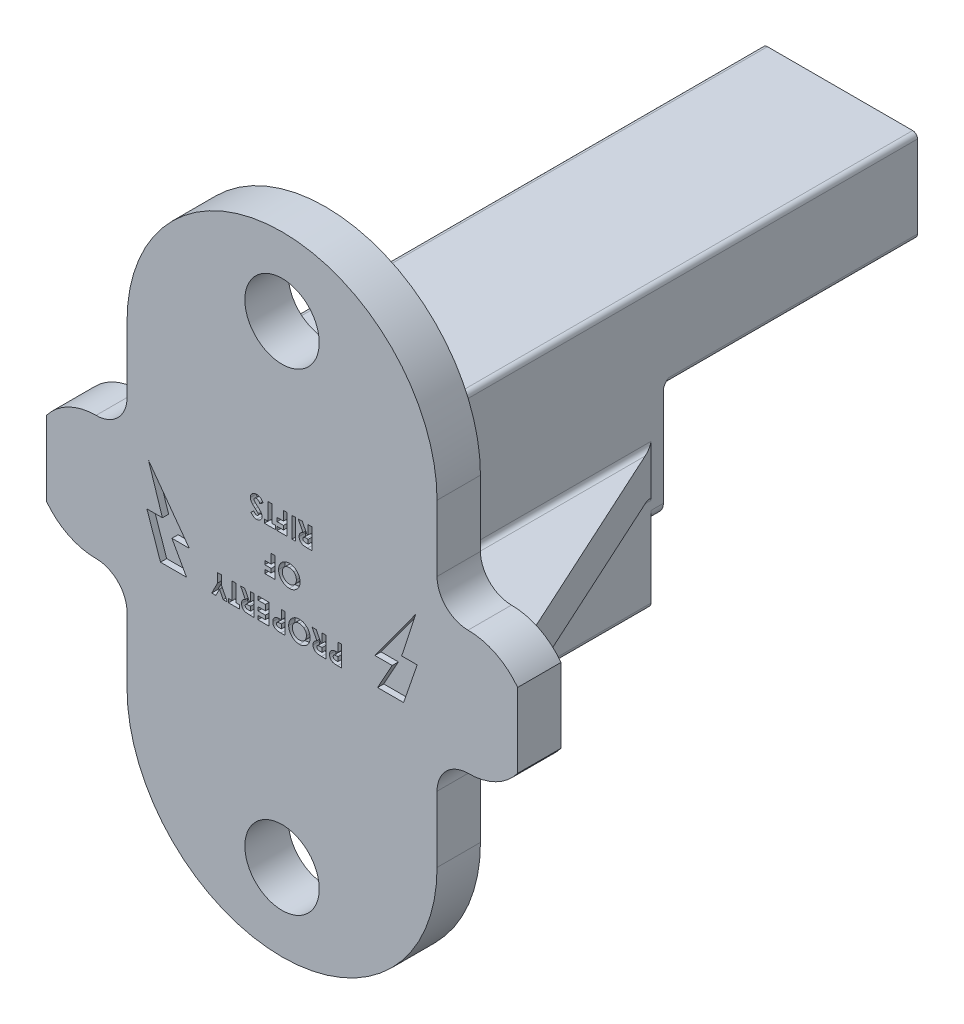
SolidWorks part; units mm, degrees
ref_plane "Front Plane" through (0, 0, 0) normal (0, 0, 1) x (1, 0, 0)
ref_plane "Top Plane" through (0, 0, 0) normal (0, 1, 0) x (1, 0, 0)
ref_plane "Right Plane" through (0, 0, 0) normal (1, 0, 0) x (0, 0, -1)
sketch "Sketch1" plane through (0, 0, 0) normal (0, 0, 1) x (1, 0, 0)
  line L1 (-683.5225, -1291.2464) -> (-651.7725, -1291.2464)
  line L2 (-683.5225, -1291.2464) -> (-683.5225, -1234.1695)
  line L3 (-683.5225, -1291.2464) -> (-651.7725, -1291.2464)
  line L4 (-683.5225, -1234.1695) -> (-651.7725, -1234.1695)
  line L5 (-651.7725, -1291.2464) -> (-651.7725, -1234.1695)
  line L6 (-658.1225, -1276.0275) -> (-677.1725, -1276.0275)
  line L7 (-683.5225, -1282.3775) -> (-683.5225, -1291.2464)
  line L8 (-651.7725, -1291.2464) -> (-651.7725, -1282.3775)
  circle A2 centre (-667.6475, -1337.5375) radius 25
  circle A4 centre (-705.1475, -1337.5375) radius 2.75
  circle A6 centre (-686.3975, -1370.0135) radius 2.75
  circle A8 centre (-648.8975, -1370.0135) radius 2.75
  circle A10 centre (-648.8975, -1305.0616) radius 2.75
  circle A12 centre (-630.1475, -1337.5375) radius 2.75
  circle A14 centre (-686.3975, -1305.0616) radius 2.75
  circle A16 centre (-659.9185, -1285.0159) radius 2.9
  circle A18 centre (-675.3764, -1285.0159) radius 2.9
  arc A28 (-677.1725, -1276.0275) -> (-683.5225, -1282.3775) centre (-677.1725, -1282.3775) ccw
  arc A29 (-687.1241, -1296.9708) -> (-683.5225, -1291.2464) centre (-689.8725, -1291.2464) ccw
  arc A30 (-687.1241, -1296.9708) -> (-648.1709, -1296.9708) centre (-667.6475, -1337.5375) ccw
  arc A31 (-651.7725, -1291.2464) -> (-648.1709, -1296.9708) centre (-645.4225, -1291.2464) ccw
  arc A32 (-651.7725, -1282.3775) -> (-658.1225, -1276.0275) centre (-658.1225, -1282.3775) ccw
extrude "Boss-Extrude1" add sketch "Sketch1" along normal blind 12.7 contours A32 L5 L4 L2 A28 L6 | L5 A32 L6 A28 L2 L1 A18 A16
sketch "Sketch2" plane through (0, 0, 12.7) normal (0, 0, 1) x (1, 0, 0)
  line L0 (-651.7725, -1272.2695) -> (-683.5225, -1272.2695)
  line L4 (-683.5225, -1234.1695) -> (-683.5225, -1291.2464)
  line L5 (-683.5225, -1291.2464) -> (-651.7725, -1291.2464)
  line L6 (-651.7725, -1291.2464) -> (-651.7725, -1234.1695)
  line L7 (-651.7725, -1234.1695) -> (-683.5225, -1234.1695)
  line L8 (-683.5225, -1234.1695) -> (-683.5225, -1291.2464)
  line L9 (-683.5225, -1291.2464) -> (-651.7725, -1291.2464)
  line L10 (-651.7725, -1291.2464) -> (-651.7725, -1234.1695)
  line L11 (-651.7725, -1234.1695) -> (-683.5225, -1234.1695)
  circle A0 centre (-675.3764, -1285.0159) radius 2.9 construction
  circle A1 centre (-659.9185, -1285.0159) radius 2.9 construction
  circle A2 centre (-675.3764, -1285.0159) radius 2.9
  circle A3 centre (-659.9185, -1285.0159) radius 2.9
  dimension "D2" = 38.1
  dimension "D1" = 0
extrude "Boss-Extrude2" add sketch "Sketch2" along normal blind 101.6 contours L0 M8 M9 M6
ref_plane "Plane1" through (-667.6475, 0, 0) normal (1, 0, 0) x (0, 0, -1)
sketch "Sketch7" plane through (0, -1272.2695, 0) normal (0, -1, 0) x (1, 0, 0)
  line L1 (-642.6475, 54.61) -> (-692.6475, 54.61)
  line L4 (-683.5225, 12.7) -> (-651.7725, 12.7)
  line L5 (-651.7725, 12.7) -> (-651.7725, 114.3)
  line L6 (-651.7725, 114.3) -> (-683.5225, 114.3)
  line L7 (-683.5225, 114.3) -> (-683.5225, 12.7)
  line L8 (-683.5225, 12.7) -> (-651.7725, 12.7)
  line L9 (-651.7725, 12.7) -> (-651.7725, 114.3)
  line L10 (-651.7725, 114.3) -> (-683.5225, 114.3)
  line L11 (-683.5225, 114.3) -> (-683.5225, 12.7)
  dimension "D1" = 0
extrude "Boss-Extrude4" add sketch "Sketch7" along normal blind 57.15 contours L1 M6 M7 M8
sketch "Sketch8" plane through (0, 0, 114.3) normal (0, 0, 1) x (1, 0, 0)
  line L4 (-683.5225, -1234.1695) -> (-683.5225, -1329.4195)
  line L5 (-683.5225, -1329.4195) -> (-651.7725, -1329.4195)
  line L6 (-651.7725, -1329.4195) -> (-651.7725, -1234.1695)
  line L7 (-651.7725, -1234.1695) -> (-683.5225, -1234.1695)
  line L8 (-683.5225, -1234.1695) -> (-683.5225, -1329.4195)
  line L9 (-683.5225, -1329.4195) -> (-651.7725, -1329.4195)
  line L10 (-651.7725, -1329.4195) -> (-651.7725, -1234.1695)
  line L11 (-651.7725, -1234.1695) -> (-683.5225, -1234.1695)
  circle A1 centre (-667.6475, -1337.5375) radius 12.3
  circle A2 centre (-667.6475, -1337.5375) radius 25 construction
  dimension "D1" = 0
  dimension "D2" = 12.7
extrude "Cut-Extrude4" cut sketch "Sketch8" against normal through all contours L9 A1
ref_plane "Plane3" through (-667.6475, 0, 0) normal (1, 0, 0) x (0, 0, -1)
sketch "Sketch11" plane through (-667.6475, 0, 0) normal (1, 0, 0) x (0, 0, -1)
  line L0 (-54.61, -1272.2695) -> (-12.7, -1272.2695) construction
  line L1 (-114.3, -1329.4195) -> (-114.3, -1234.1695) construction
  line L2 (0, -1291.2464) -> (0, -1234.1695) construction
  line L3 (-54.61, -1272.2695) -> (-12.7, -1272.2695) construction
  line L4 (-114.3, -1329.4195) -> (-114.3, -1234.1695) construction
  line L5 (0, -1291.2464) -> (0, -1234.1695) construction
  line L6 (-54.61, -1272.2695) -> (-114.3, -1272.2695) construction
  line L7 (0, -1243.1425) -> (-114.3, -1263.2966)
  line L8 (-114.3, -1234.1695) -> (0, -1234.1695) construction
  line L9 (0, -1234.1695) -> (0, -1243.1425) construction
  line L10 (-114.3, -1263.2966) -> (-114.3, -1272.2695) construction
  point P6 (0, -1243.1425)
  dimension "D1" = 10
ref_plane "Plane4" through (-667.6475, -1243.1425, 0) normal (0, -0.1736, 0.9848) x (1, 0, 0)
sketch "Sketch13" plane through (-667.6475, -1243.1425, 0) normal (0, -0.1736, 0.9848) x (1, 0, 0)
  line L8 (28.575, 21.5366) -> (-28.575, 21.5366)
  line L9 (28.575, -60.0731) -> (28.575, 21.5366)
  line L10 (-28.575, -60.0731) -> (28.575, -60.0731)
  line L11 (-28.575, 21.5366) -> (-28.575, -60.0731)
  line L12 (28.575, 21.5366) -> (-28.575, 21.5366)
  line L13 (28.575, -60.0731) -> (28.575, 21.5366)
  line L14 (-28.575, -60.0731) -> (28.575, -60.0731)
  line L15 (-28.575, 21.5366) -> (-28.575, -60.0731)
  dimension "D1" = 12.7
sketch "Sketch16" plane through (0, 0, 54.61) normal (0, 0, -1) x (-1, 0, 0)
  line L5 (676.8881, -1329.4195) -> (683.5225, -1329.4195)
  line L6 (683.5225, -1329.4195) -> (683.5225, -1272.2695)
  line L7 (683.5225, -1272.2695) -> (651.7725, -1272.2695)
  line L8 (651.7725, -1272.2695) -> (651.7725, -1329.4195)
  line L9 (651.7725, -1329.4195) -> (658.4069, -1329.4195)
  line L10 (676.8881, -1329.4195) -> (683.5225, -1329.4195)
  line L11 (683.5225, -1329.4195) -> (683.5225, -1272.2695)
  line L12 (683.5225, -1272.2695) -> (651.7725, -1272.2695)
  line L13 (651.7725, -1272.2695) -> (651.7725, -1329.4195)
  line L14 (651.7725, -1329.4195) -> (658.4069, -1329.4195)
  arc A1 (676.8881, -1329.4195) -> (658.4069, -1329.4195) centre (667.6475, -1337.5375) ccw
  arc A2 (676.8881, -1329.4195) -> (658.4069, -1329.4195) centre (667.6475, -1337.5375) ccw
  circle A3 centre (667.6475, -1337.5375) radius 25 construction
  circle A4 centre (667.6475, -1337.5375) radius 26.27
  dimension "D1" = 0
  dimension "D2" = 1.27
extrude "Boss-Extrude6" add sketch "Sketch16" along normal blind 2.54 contours A4 L11 M10 M11
fillet "Fillet8" radius 2.54 2 edges at (-683.5225, -1316.6067, 53.34) (-651.7725, -1316.6067, 53.34)
sketch "Sketch19" plane through (0, 0, 114.3) normal (0, 0, 1) x (1, 0, 0)
  line L0 (-669.4127, -1270.1271) -> (-661.9715, -1270.1271)
  line L1 (-661.9715, -1270.1271) -> (-666.1374, -1277.5684)
  line L2 (-666.1374, -1277.5684) -> (-661.167, -1277.5684)
  line L3 (-661.167, -1277.5684) -> (-672.9466, -1293.8012)
  line L4 (-672.9466, -1293.8012) -> (-668.8668, -1281.4183)
  line L5 (-668.8668, -1281.4183) -> (-673.5499, -1281.4183)
  line L6 (-673.5499, -1281.4183) -> (-669.4127, -1270.1271)
  line L7 (-668.8668, -1281.4183) -> (-666.1374, -1277.5684) construction
sketch "Sketch20" plane through (0, 0, 12.7) normal (0, 0, 1) x (1, 0, 0)
  line L4 (-683.5225, -1272.2695) -> (-683.5225, -1291.2464)
  line L5 (-683.5225, -1291.2464) -> (-651.7725, -1291.2464)
  line L6 (-651.7725, -1291.2464) -> (-651.7725, -1272.2695)
  line L7 (-651.7725, -1272.2695) -> (-683.5225, -1272.2695)
  line L8 (-683.5225, -1272.2695) -> (-683.5225, -1291.2464)
  line L9 (-683.5225, -1291.2464) -> (-651.7725, -1291.2464)
  line L10 (-651.7725, -1291.2464) -> (-651.7725, -1272.2695)
  line L11 (-651.7725, -1272.2695) -> (-683.5225, -1272.2695)
  circle A0 centre (-659.9185, -1285.0159) radius 2.9 construction
  circle A1 centre (-675.3764, -1285.0159) radius 2.9 construction
  circle A6 centre (-659.9185, -1285.0159) radius 2.9
  circle A7 centre (-675.3764, -1285.0159) radius 2.9
  dimension "D1" = 0
extrude "Boss-Extrude7" add sketch "Sketch20" along normal up to surface (39.37 mm away)
sketch "Sketch21" plane through (0, 0, 0) normal (0, 0, -1) x (-1, 0, 0)
  line L0 (651.7725, -1253.2195) -> (683.5225, -1253.2195)
  line L4 (651.7725, -1291.2464) -> (683.5225, -1291.2464)
  line L5 (683.5225, -1291.2464) -> (683.5225, -1234.1695)
  line L6 (683.5225, -1234.1695) -> (651.7725, -1234.1695)
  line L7 (651.7725, -1234.1695) -> (651.7725, -1291.2464)
  line L8 (651.7725, -1291.2464) -> (683.5225, -1291.2464)
  line L9 (683.5225, -1291.2464) -> (683.5225, -1234.1695)
  line L10 (683.5225, -1234.1695) -> (651.7725, -1234.1695)
  line L11 (651.7725, -1234.1695) -> (651.7725, -1291.2464)
  dimension "D2" = 19.05
  dimension "D1" = 0
extrude "Cut-Extrude5" cut sketch "Sketch21" against normal through all contours L0 M12 M10 M11
sketch "Sketch22" plane through (-667.6475, 0, 0) normal (1, 0, 0) x (0, 0, -1)
  line L0 (-1.6908, -1262.8083) -> (-114.3, -1282.6643)
  line L10 (0, -1253.2195) -> (-114.3, -1253.2195)
  line L11 (-114.3, -1253.2195) -> (-114.3, -1329.4195)
  line L12 (-114.3, -1329.4195) -> (-54.61, -1329.4195)
  line L13 (-54.61, -1329.4195) -> (-54.61, -1311.9994)
  line L14 (-54.61, -1311.9994) -> (-52.07, -1311.9994)
  line L15 (-54.61, -1311.9994) -> (-52.07, -1311.9994)
  line L16 (-52.07, -1311.9994) -> (-52.07, -1291.2464)
  line L17 (0, -1291.2464) -> (0, -1253.2195)
  line L19 (0, -1253.2195) -> (-114.3, -1253.2195) construction
  line L20 (-114.3, -1253.2195) -> (-114.3, -1329.4195) construction
  line L21 (-114.3, -1329.4195) -> (-54.61, -1329.4195) construction
  line L22 (-54.61, -1329.4195) -> (-54.61, -1311.9994) construction
  line L26 (0, -1291.2464) -> (0, -1253.2195) construction
  line L28 (-52.07, -1311.9994) -> (-52.07, -1291.2464)
  line L29 (-52.07, -1291.2464) -> (0, -1291.2464)
  line L30 (-52.07, -1291.2464) -> (0, -1291.2464)
  point P2 (-1.6908, -1262.8083)
  point P8 (-1.6908, -1262.8083)
  dimension "D3" = 10
  dimension "D1" = 0
sketch "Sketch23" plane through (-667.6475, -1243.1425, 0) normal (0, -0.1736, 0.9848) x (1, 0, 0)
  circle A0 centre (0, -19.0735) radius 4.7625 construction
  circle A1 centre (0, -19.0735) radius 5.1625
  point P0 (0, -19.0735)
  dimension "D1" = 9.525
  dimension "D2" = 0.4
sketch "Sketch24" plane through (0, 0, 54.61) normal (0, 0, -1) x (-1, 0, 0)
  line L4 (683.5225, -1329.4195) -> (683.5225, -1311.9994)
  line L5 (651.7725, -1311.9994) -> (651.7725, -1329.4195)
  line L6 (651.7725, -1329.4195) -> (658.4069, -1329.4195)
  line L7 (676.8881, -1329.4195) -> (683.5225, -1329.4195)
  line L8 (683.5225, -1329.4195) -> (683.5225, -1311.9994)
  line L9 (651.7725, -1311.9994) -> (651.7725, -1329.4195)
  line L10 (651.7725, -1329.4195) -> (658.4069, -1329.4195)
  line L11 (676.8881, -1329.4195) -> (683.5225, -1329.4195)
  arc A4 (679.8068, -1314.251) -> (683.5225, -1311.9994) centre (680.9825, -1311.9994) ccw
  arc A5 (679.8068, -1314.251) -> (655.4882, -1314.251) centre (667.6475, -1337.5375) ccw
  arc A6 (651.7725, -1311.9994) -> (655.4882, -1314.251) centre (654.3125, -1311.9994) ccw
  arc A7 (676.8881, -1329.4195) -> (658.4069, -1329.4195) centre (667.6475, -1337.5375) ccw
  arc A8 (679.8068, -1314.251) -> (683.5225, -1311.9994) centre (680.9825, -1311.9994) ccw
  arc A9 (679.8068, -1314.251) -> (655.4882, -1314.251) centre (667.6475, -1337.5375) ccw
  arc A10 (651.7725, -1311.9994) -> (655.4882, -1314.251) centre (654.3125, -1311.9994) ccw
  arc A11 (676.8881, -1329.4195) -> (658.4069, -1329.4195) centre (667.6475, -1337.5375) ccw
  dimension "D1" = 0
sketch "Sketch25" plane through (0, 0, 52.07) normal (0, 0, -1) x (-1, 0, 0)
  line L3 (683.5225, -1311.9994) -> (683.5225, -1291.2464)
  line L4 (683.5225, -1291.2464) -> (651.7725, -1291.2464)
  line L5 (651.7725, -1291.2464) -> (651.7725, -1311.9994)
  line L6 (683.5225, -1311.9994) -> (683.5225, -1291.2464)
  line L7 (683.5225, -1291.2464) -> (651.7725, -1291.2464)
  line L8 (651.7725, -1291.2464) -> (651.7725, -1311.9994)
  arc A7 (651.7725, -1311.9994) -> (655.4882, -1314.251) centre (654.3125, -1311.9994) ccw
  arc A8 (679.8068, -1314.251) -> (655.4882, -1314.251) centre (667.6475, -1337.5375) ccw
  arc A9 (679.8068, -1314.251) -> (683.5225, -1311.9994) centre (680.9825, -1311.9994) ccw
  arc A12 (651.7725, -1311.9994) -> (655.4882, -1314.251) centre (654.3125, -1311.9994) ccw
  arc A13 (679.8068, -1314.251) -> (655.4882, -1314.251) centre (667.6475, -1337.5375) ccw
  arc A14 (679.8068, -1314.251) -> (683.5225, -1311.9994) centre (680.9825, -1311.9994) ccw
  dimension "D1" = 0
sketch "Sketch30" plane through (0, 0, 0) normal (0, 0, -1) x (-1, 0, 0)
  circle A0 centre (659.9185, -1285.0159) radius 3.302
  circle A1 centre (675.3764, -1285.0159) radius 2.9
  circle A2 centre (675.3764, -1285.0159) radius 2.9
  circle A3 centre (659.9185, -1285.0159) radius 2.9
  circle A4 centre (659.9185, -1285.0159) radius 2.9
  circle A5 centre (675.3764, -1285.0159) radius 3.302
  dimension "D3" = 6.604
  dimension "D1" = 0
  dimension "D2" = 0
sketch "Sketch31" plane through (0, 0, 0) normal (0, 0, -1) x (-1, 0, 0)
  line L0 (654.3125, -1272.397) -> (651.7725, -1272.397)
  line L1 (680.9825, -1272.397) -> (683.5225, -1272.397)
  line L4 (683.5225, -1291.2464) -> (683.5225, -1253.2195)
  line L5 (683.5225, -1253.2195) -> (651.7725, -1253.2195)
  line L6 (651.7725, -1253.2195) -> (651.7725, -1291.2464)
  line L7 (651.7725, -1291.2464) -> (683.5225, -1291.2464)
  line L8 (683.5225, -1291.2464) -> (683.5225, -1253.2195)
  line L9 (683.5225, -1253.2195) -> (651.7725, -1253.2195)
  line L10 (651.7725, -1253.2195) -> (651.7725, -1291.2464)
  line L11 (651.7725, -1291.2464) -> (683.5225, -1291.2464)
  line L14 (683.5225, -1291.2464) -> (683.5225, -1274.937)
  line L15 (680.9825, -1272.397) -> (654.3125, -1272.397)
  line L16 (651.7725, -1274.937) -> (651.7725, -1291.2464)
  arc A10 (683.5225, -1274.937) -> (680.9825, -1272.397) centre (680.9825, -1274.937) ccw
  arc A11 (654.3125, -1272.397) -> (651.7725, -1274.937) centre (654.3125, -1274.937) ccw
  arc A12 (648.1709, -1296.9708) -> (651.7725, -1291.2464) centre (645.4225, -1291.2464) ccw
  arc A13 (648.1709, -1296.9708) -> (687.1241, -1296.9708) centre (667.6475, -1337.5375) ccw
  arc A14 (683.5225, -1291.2464) -> (687.1241, -1296.9708) centre (689.8725, -1291.2464) ccw
  dimension "D1" = 0
extrude "Cut-Extrude11" cut sketch "Sketch31" against normal through all contours L15 L1 L0 M15 M16 M17
sketch "Sketch35" plane through (-667.6475, 0, 0) normal (1, 0, 0) x (0, 0, -1)
  line L0 (0, -1291.2464) -> (-52.07, -1305.1985)
  line L1 (-52.07, -1291.2464) -> (0, -1291.2464) construction
  line L2 (0, -1291.2464) -> (0, -1272.397) construction
  line L3 (-52.07, -1291.2464) -> (-52.07, -1311.9994) construction
  dimension "D1" = 15
rib "Rib1" sketch "Sketch35" sketch "Sketch35" thickness 8.4667 extrusion direction parallel to sketch draft on no parameters "D1"=8.4667
sketch "Sketch38" plane through (0, 0, 52.07) normal (0, 0, -1) x (-1, 0, 0)
  circle A0 centre (675.3764, -1285.0159) radius 2.9 construction
  circle A1 centre (659.9185, -1285.0159) radius 2.9 construction
  circle A2 centre (675.3764, -1285.0159) radius 2.9
  circle A3 centre (659.9185, -1285.0159) radius 2.9
extrude "Boss-Extrude9" add sketch "Sketch38" along normal up to surface (52.07 mm away)
sketch "Sketch39" plane through (0, 0, 0) normal (0, 0, -1) x (-1, 0, 0)
  circle A2 centre (659.71, -1281.8217) radius 3.302
  circle A3 centre (675.585, -1281.8217) radius 3.302
  dimension "D1" = 6.604
extrude "Cut-Extrude13" cut sketch "Sketch39" against normal blind 38.89
sketch "Sketch41" plane through (0, 0, 114.3) normal (0, 0, 1) x (1, 0, 0)
  line L0 (-667.6475, -1301.6974) -> (-667.6475, -1325.2375) construction
  line L1 (-667.6475, -1301.6974) -> (-670.9837, -1301.6974) construction
  line L2 (-654.9475, -1307.7073) -> (-680.3475, -1307.7073) construction
  line L3 (-651.7725, -1272.397) -> (-683.5225, -1272.397)
  line L4 (-683.5225, -1329.4195) -> (-676.8881, -1329.4195)
  line L5 (-658.4069, -1329.4195) -> (-651.7725, -1329.4195)
  line L6 (-651.7725, -1272.397) -> (-683.5225, -1272.397) construction
  line L7 (-683.5225, -1329.4195) -> (-676.8881, -1329.4195) construction
  line L8 (-658.4069, -1329.4195) -> (-651.7725, -1329.4195) construction
  line L9 (-654.9475, -1298.8173) -> (-680.3475, -1298.8173) construction
  line L10 (-654.9475, -1289.9273) -> (-680.3475, -1289.9273) construction
  arc A3 (-651.7725, -1329.4195) -> (-651.7725, -1272.397) centre (-651.7725, -1300.9083) ccw
  arc A4 (-683.5225, -1272.397) -> (-683.5225, -1329.4195) centre (-683.5225, -1300.9083) ccw
  arc A5 (-658.4069, -1329.4195) -> (-676.8881, -1329.4195) centre (-667.6475, -1337.5375) ccw
  arc A6 (-651.7725, -1329.4195) -> (-651.7725, -1272.397) centre (-651.7725, -1300.9083) ccw construction
  arc A7 (-683.5225, -1272.397) -> (-683.5225, -1329.4195) centre (-683.5225, -1300.9083) ccw construction
  arc A8 (-658.4069, -1329.4195) -> (-676.8881, -1329.4195) centre (-667.6475, -1337.5375) ccw construction
  text T0 "<b>PROPERTY</b>" font "Century Gothic" height in points 16
  text T1 "<b>OF</b>" font "Century Gothic" height in points 16
  text T2 "<b>RIFTS</b>" font "Century Gothic" height in points 16
  point P0 (-667.6475, -1313.4674)
  point P14 (-667.6475, -1289.9273)
  point P18 (-667.6475, -1313.4674)
  point P19 (-667.6475, -1301.6974)
  point P23 (-667.6475, -1289.9273)
  dimension "D2" = 25.4
  dimension "D3" = 8.89
  dimension "D4" = 8.89
  dimension "D1" = 0
sketch "Sketch42" plane through (0, 0, 114.3) normal (0, 0, 1) x (1, 0, 0)
  line L0 (-667.6475, -1272.397) -> (-667.6475, -1337.5375) construction
  line L1 (-635.8975, -1272.397) -> (-635.8975, -1337.5375)
  line L2 (-699.3975, -1272.397) -> (-699.3975, -1337.5375)
  line L5 (-658.4069, -1329.4195) -> (-651.7725, -1329.4195)
  line L6 (-651.7725, -1329.4195) -> (-651.7725, -1272.397)
  line L7 (-651.7725, -1272.397) -> (-683.5225, -1272.397)
  line L8 (-683.5225, -1272.397) -> (-683.5225, -1329.4195)
  line L9 (-683.5225, -1329.4195) -> (-676.8881, -1329.4195)
  line L10 (-658.4069, -1329.4195) -> (-651.7725, -1329.4195)
  line L11 (-651.7725, -1329.4195) -> (-651.7725, -1272.397)
  line L12 (-651.7725, -1272.397) -> (-683.5225, -1272.397)
  line L13 (-683.5225, -1272.397) -> (-683.5225, -1329.4195)
  line L14 (-683.5225, -1329.4195) -> (-676.8881, -1329.4195)
  arc A0 (-635.8975, -1272.397) -> (-699.3975, -1272.397) centre (-667.6475, -1272.397) ccw
  arc A1 (-699.3975, -1337.5375) -> (-635.8975, -1337.5375) centre (-667.6475, -1337.5375) ccw
  arc A5 (-658.4069, -1329.4195) -> (-676.8881, -1329.4195) centre (-667.6475, -1337.5375) ccw
  arc A8 (-658.4069, -1329.4195) -> (-676.8881, -1329.4195) centre (-667.6475, -1337.5375) ccw
  point P9 (-667.6475, -1304.9673)
  dimension "D2" = 31.75
  dimension "D1" = 0
extrude "Boss-Extrude10" add sketch "Sketch42" against normal blind 8.89
sketch "Sketch43" plane through (0, 0, 105.41) normal (0, 0, -1) x (-1, 0, 0)
  line L0 (635.8975, -1272.397) -> (699.3975, -1272.397) construction
  line L1 (667.6475, -1272.397) -> (667.6475, -1240.647) construction
  line L2 (699.3975, -1337.5375) -> (699.3975, -1272.397)
  line L3 (635.8975, -1272.397) -> (635.8975, -1337.5375)
  line L4 (699.3975, -1337.5375) -> (699.3975, -1272.397)
  line L5 (635.8975, -1272.397) -> (635.8975, -1337.5375)
  line L6 (699.3975, -1337.5375) -> (635.8975, -1337.5375) construction
  line L7 (667.6475, -1337.5375) -> (667.6475, -1369.2875) construction
  circle A0 centre (667.6475, -1353.4125) radius 7.62
  circle A1 centre (667.6475, -1256.522) radius 7.62
  arc A2 (699.3975, -1272.397) -> (635.8975, -1272.397) centre (667.6475, -1272.397) ccw
  arc A3 (635.8975, -1337.5375) -> (699.3975, -1337.5375) centre (667.6475, -1337.5375) ccw
  arc A4 (699.3975, -1272.397) -> (635.8975, -1272.397) centre (667.6475, -1272.397) ccw
  arc A5 (635.8975, -1337.5375) -> (699.3975, -1337.5375) centre (667.6475, -1337.5375) ccw
  dimension "D2" = 15.24
  dimension "D1" = 0
extrude "Cut-Extrude14" cut sketch "Sketch43" against normal through all contours A1 | A0
ref_plane "Plane5" through (0, -1300.9083, 0) normal (0, -1, 0) x (-1, 0, 0)
ref_plane "Plane6" through (-667.6475, 0, 0) normal (1, 0, 0) x (0, 0, -1)
fillet "Fillet12" radius 1 4 edges at (-651.7725, -1291.2464, 26.035) (-683.5225, -1291.2464, 26.035) (-651.7725, -1272.397, 52.705) (-683.5225, -1272.397, 52.705)
extrude "Cut-Extrude16" cut sketch "Sketch41" against normal blind 1.27
sketch "Sketch44" plane through (0, 0, 105.41) normal (0, 0, -1) x (-1, 0, 0)
  line L0 (635.8975, -1304.9673) -> (629.5475, -1304.9673) construction
  line L1 (635.8975, -1304.9673) -> (629.5475, -1304.9673) construction
  line L2 (699.3975, -1337.5375) -> (699.3975, -1272.397)
  line L3 (635.8975, -1272.397) -> (635.8975, -1337.5375)
  line L4 (699.3975, -1337.5375) -> (699.3975, -1272.397)
  line L5 (635.8975, -1272.397) -> (635.8975, -1337.5375)
  line L6 (635.8975, -1317.6673) -> (629.5475, -1317.6673)
  line L7 (635.8975, -1292.2673) -> (629.5475, -1292.2673)
  line L8 (667.6475, -1240.647) -> (667.6475, -1253.0756) construction
  line L9 (699.3975, -1304.9673) -> (705.7475, -1304.9673) construction
  line L10 (699.3975, -1304.9673) -> (705.7475, -1304.9673) construction
  line L11 (699.3975, -1317.6673) -> (705.7475, -1317.6673)
  line L12 (699.3975, -1292.2673) -> (705.7475, -1292.2673)
  arc A0 (635.8975, -1317.6673) -> (635.8975, -1292.2673) centre (635.8975, -1304.9673) ccw
  arc A1 (629.5475, -1292.2673) -> (629.5475, -1317.6673) centre (629.5475, -1304.9673) ccw
  arc A2 (699.3975, -1272.397) -> (635.8975, -1272.397) centre (667.6475, -1272.397) ccw
  arc A3 (635.8975, -1337.5375) -> (699.3975, -1337.5375) centre (667.6475, -1337.5375) ccw
  arc A4 (699.3975, -1272.397) -> (635.8975, -1272.397) centre (667.6475, -1272.397) ccw
  arc A5 (635.8975, -1337.5375) -> (699.3975, -1337.5375) centre (667.6475, -1337.5375) ccw
  arc A6 (699.3975, -1317.6673) -> (699.3975, -1292.2673) centre (699.3975, -1304.9673) cw
  arc A7 (705.7475, -1292.2673) -> (705.7475, -1317.6673) centre (705.7475, -1304.9673) cw
  point P8 (632.7225, -1304.9673)
  point P17 (702.5725, -1304.9673)
  dimension "D2" = 12.7
  dimension "D3" = 6.35
  dimension "D1" = 0
extrude "Boss-Extrude11" add sketch "Sketch44" against normal up to surface (8.89 mm away) contours L7 A1 L6 L5 | A7 L12 L4 L11
fillet "Fillet14" radius 6.35 4 edges at (-699.3975, -1292.2673, 109.855) (-699.3975, -1317.6673, 109.855) (-635.8975, -1292.2673, 109.855) (-635.8975, -1317.6673, 109.855)
ref_plane "Plane7" through (0, -1304.9673, 0) normal (0, -1, 0) x (-1, 0, 0)
sketch "Sketch45" plane through (0, -1304.9673, 0) normal (0, -1, 0) x (-1, 0, 0)
  line L0 (651.7725, -54.61) -> (628.4892, -105.41)
rib "Rib4" sketch "Sketch45" sketch "Sketch45" thickness 8.4667 extrusion direction parallel to sketch draft on no parameters "D1"=8.4667
mirror "Mirror1" about plane through (-667.6475, 0, 0) normal (1, 0, 0) of "Rib4"
fillet "Fillet15" radius 1 6 edges at (-683.5225, -1309.2006, 80.01) (-706.8058, -1304.9673, 105.41) (-683.5225, -1300.7339, 80.01) (-628.4892, -1304.9673, 105.41) (-651.7725, -1300.7339, 80.01) (-651.7725, -1309.2006, 80.01)
fillet "Fillet17" radius 1 3 edges at (-667.6475, -1305.1985, 52.07) (-663.4142, -1291.2464, 26.035) (-671.8808, -1291.2464, 26.035)
fillet "Fillet18" radius 1 7 edges at (-671.8808, -1299.1061, 52.07) (-672.1737, -1291.5392, 52.07) (-683.2296, -1290.9535, 52.07) (-652.0654, -1290.9535, 52.07) (-663.4142, -1299.1061, 52.07) (-663.1213, -1291.5392, 52.07) (-657.5933, -1291.2464, 52.07)
sketch "Sketch46" plane through (0, 0, 114.3) normal (0, 0, 1) x (1, 0, 0)
  line L14 (-695.0062, -1294.837) -> (-692.1539, -1303.6349)
  line L15 (-692.1539, -1303.6349) -> (-695.3347, -1303.6349)
  line L16 (-695.3347, -1303.6349) -> (-692.5427, -1311.7125)
  line L17 (-692.5427, -1311.7125) -> (-687.2139, -1311.7125)
  line L18 (-687.2139, -1311.7125) -> (-690.2099, -1306.2996)
  line L19 (-690.2099, -1306.2996) -> (-686.6539, -1306.2996)
  line L20 (-686.6539, -1306.2996) -> (-695.0062, -1294.837)
  line L21 (-642.7523, -1311.7125) -> (-639.9603, -1303.6349)
  line L22 (-639.9603, -1303.6349) -> (-643.1411, -1303.6349)
  line L23 (-643.1411, -1303.6349) -> (-640.2887, -1294.837)
  line L24 (-640.2887, -1294.837) -> (-648.6411, -1306.2996)
  line L25 (-648.6411, -1306.2996) -> (-645.085, -1306.2996)
  line L26 (-645.085, -1306.2996) -> (-648.0811, -1311.7125)
  line L27 (-648.0811, -1311.7125) -> (-642.7523, -1311.7125)
extrude "Cut-Extrude17" cut sketch "Sketch46" against normal blind 1.27
sketch "Sketch47" plane through (0, 0, 54.61) normal (0, 0, -1) x (-1, 0, 0)
  line L4 (651.7725, -1311.9994) -> (651.7725, -1329.4195)
  line L5 (651.7725, -1329.4195) -> (658.4069, -1329.4195)
  line L6 (676.8881, -1329.4195) -> (683.5225, -1329.4195)
  line L7 (683.5225, -1329.4195) -> (683.5225, -1311.9994)
  line L8 (651.7725, -1311.9994) -> (651.7725, -1329.4195)
  line L9 (651.7725, -1329.4195) -> (658.4069, -1329.4195)
  line L10 (676.8881, -1329.4195) -> (683.5225, -1329.4195)
  line L11 (683.5225, -1329.4195) -> (683.5225, -1311.9994)
  circle A0 centre (667.6475, -1337.5375) radius 12.5
  circle A1 centre (667.6475, -1337.5375) radius 15.04
  arc A7 (676.8881, -1329.4195) -> (658.4069, -1329.4195) centre (667.6475, -1337.5375) ccw
  arc A9 (679.8068, -1314.251) -> (683.5225, -1311.9994) centre (680.9825, -1311.9994) ccw
  arc A10 (679.8068, -1314.251) -> (655.4882, -1314.251) centre (667.6475, -1337.5375) ccw
  arc A11 (651.7725, -1311.9994) -> (655.4882, -1314.251) centre (654.3125, -1311.9994) ccw
  arc A13 (676.8881, -1329.4195) -> (658.4069, -1329.4195) centre (667.6475, -1337.5375) ccw
  arc A15 (679.8068, -1314.251) -> (683.5225, -1311.9994) centre (680.9825, -1311.9994) ccw
  arc A16 (679.8068, -1314.251) -> (655.4882, -1314.251) centre (667.6475, -1337.5375) ccw
  arc A17 (651.7725, -1311.9994) -> (655.4882, -1314.251) centre (654.3125, -1311.9994) ccw
  dimension "D2" = 25
  dimension "D1" = 0
  dimension "D3" = 2.54
extrude "Cut-Extrude19" cut sketch "Sketch47" against normal up to surface (50.8 mm away) contours L10 A1 L9 A0 | A0 L9 M16 M15
fillet "Fillet19" radius 1 4 edges at (-680.3085, -1329.4195, 80.01) (-683.5225, -1329.4195, 80.01) (-654.9865, -1329.4195, 80.01) (-651.7725, -1329.4195, 80.01)
fillet "Fillet20" radius 1 22 edges at (-639.31, -1300.7339, 105.41) (-651.4796, -1300.441, 105.41) (-695.985, -1300.7339, 105.41) (-683.8154, -1300.441, 105.41) (-683.5225, -1286.5655, 105.41) (-683.2296, -1272.6899, 105.41) (-667.6475, -1272.397, 105.41) (-652.0654, -1272.6899, 105.41) (-695.985, -1309.2006, 105.41) (-683.8154, -1309.4935, 105.41) (-683.5225, -1319.3101, 105.41) (-683.2296, -1329.1267, 105.41) (-681.6832, -1329.4195, 105.41) (-680.3793, -1329.3051, 105.41) (-667.6475, -1322.4975, 105.41) (-654.9156, -1329.3051, 105.41) (-653.6118, -1329.4195, 105.41) (-652.0654, -1329.1267, 105.41) (-639.31, -1309.2006, 105.41) (-651.4796, -1309.4935, 105.41) (-651.7725, -1286.5655, 105.41) (-651.7725, -1319.3101, 105.41)
sketch "Sketch48" plane through (0, 0, 105.41) normal (0, 0, -1) x (-1, 0, 0)
  line L0 (667.6475, -1240.647) -> (667.6475, -1369.2875) construction
  line L1 (718.4475, -1304.9673) -> (616.8475, -1304.9673) construction
  line L2 (680.0909, -1366.7475) -> (655.2041, -1366.7475)
  line L3 (619.3875, -1297.3473) -> (619.3875, -1312.5873)
  line L4 (635.8975, -1324.0173) -> (635.8975, -1337.5375)
  line L5 (699.3975, -1337.5375) -> (699.3975, -1324.0173)
  line L6 (699.3975, -1285.9173) -> (699.3975, -1272.397)
  line L7 (635.8975, -1272.397) -> (635.8975, -1285.9173)
  line L8 (635.8975, -1324.0173) -> (635.8975, -1337.5375)
  line L9 (699.3975, -1337.5375) -> (699.3975, -1324.0173)
  line L10 (699.3975, -1285.9173) -> (699.3975, -1272.397)
  line L11 (635.8975, -1272.397) -> (635.8975, -1285.9173)
  line L12 (715.9075, -1297.3473) -> (715.9075, -1312.5873)
  line L13 (680.0909, -1243.187) -> (655.2041, -1243.187)
  arc A8 (629.5475, -1292.2673) -> (629.5475, -1317.6673) centre (629.5475, -1304.9673) ccw
  arc A9 (635.8975, -1324.0173) -> (629.5475, -1317.6673) centre (629.5475, -1324.0173) ccw
  arc A10 (635.8975, -1337.5375) -> (699.3975, -1337.5375) centre (667.6475, -1337.5375) ccw
  arc A11 (705.7475, -1317.6673) -> (699.3975, -1324.0173) centre (705.7475, -1324.0173) ccw
  arc A12 (705.7475, -1317.6673) -> (705.7475, -1292.2673) centre (705.7475, -1304.9673) ccw
  arc A13 (699.3975, -1285.9173) -> (705.7475, -1292.2673) centre (705.7475, -1285.9173) ccw
  arc A14 (699.3975, -1272.397) -> (635.8975, -1272.397) centre (667.6475, -1272.397) ccw
  arc A15 (629.5475, -1292.2673) -> (635.8975, -1285.9173) centre (629.5475, -1285.9173) ccw
  arc A16 (629.5475, -1292.2673) -> (629.5475, -1317.6673) centre (629.5475, -1304.9673) ccw
  arc A17 (635.8975, -1324.0173) -> (629.5475, -1317.6673) centre (629.5475, -1324.0173) ccw
  arc A18 (635.8975, -1337.5375) -> (699.3975, -1337.5375) centre (667.6475, -1337.5375) ccw
  arc A19 (705.7475, -1317.6673) -> (699.3975, -1324.0173) centre (705.7475, -1324.0173) ccw
  arc A20 (705.7475, -1317.6673) -> (705.7475, -1292.2673) centre (705.7475, -1304.9673) ccw
  arc A21 (699.3975, -1285.9173) -> (705.7475, -1292.2673) centre (705.7475, -1285.9173) ccw
  arc A22 (699.3975, -1272.397) -> (635.8975, -1272.397) centre (667.6475, -1272.397) ccw
  arc A23 (629.5475, -1292.2673) -> (635.8975, -1285.9173) centre (629.5475, -1285.9173) ccw
  point P16 (619.3875, -1304.9673)
  point P19 (667.6475, -1366.7475)
  point P29 (667.6475, -1366.7475)
  point P32 (619.3875, -1304.9673)
  dimension "D2" = 2.54
  dimension "D3" = 2.54
  dimension "D1" = 0
extrude "Cut-Extrude20" cut sketch "Sketch48" against normal through all contours L3 M37 | L12 M43
